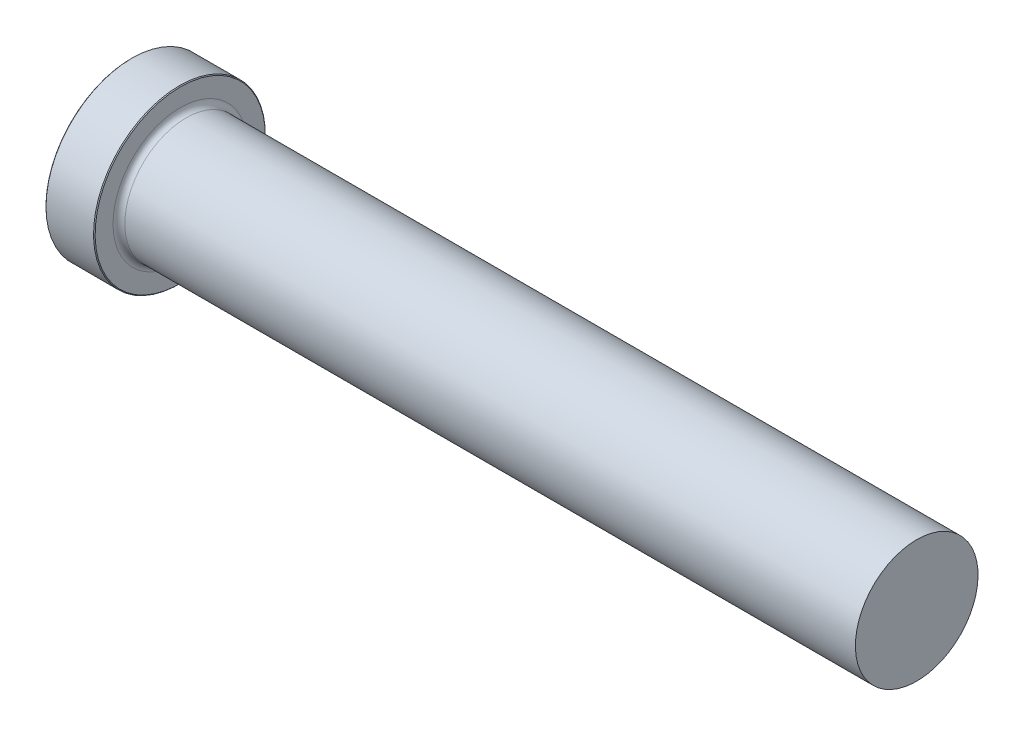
SolidWorks part; units mm, degrees
ref_plane "Front Plane" through (0, 0, 0) normal (0, 0, 1) x (1, 0, 0)
ref_plane "Top Plane" through (0, 0, 0) normal (0, 1, 0) x (1, 0, 0)
ref_plane "Right Plane" through (0, 0, 0) normal (1, 0, 0) x (0, 0, -1)
sketch "Sketch1" plane through (0, 0, 0) normal (0, 0, 1) x (1, 0, 0)
  line L0 (0, 0) -> (0, 11.1125)
  line L1 (0, 11.1125) -> (6.35, 11.1125)
  line L2 (6.35, 11.1125) -> (6.35, 8.6931)
  line L3 (7.112, 7.9311) -> (101.6, 7.9311)
  line L4 (101.6, 7.9311) -> (101.6, 0)
  line L5 (101.6, 0) -> (0, 0)
  line L6 (101.6, 0) -> (101.6, -7.9311) construction
  line L7 (101.6, -7.9311) -> (6.35, -7.9312) construction
  line L8 (0, 0) -> (0, -11.1125) construction
  line L9 (0, -11.1125) -> (6.35, -11.1125) construction
  line L10 (6.35, -11.1125) -> (6.35, -7.9312) construction
  arc A0 (6.35, 8.6931) -> (7.112, 7.9311) centre (7.112, 8.6931) ccw
  dimension "D4" = 0.762
  dimension "L" = 101.6
  dimension "D" = 15.8623
  dimension "H" = 22.225
  dimension "T" = 6.35
revolve "Revolve1" add sketch "Sketch1" angle 360 about L5
chamfer "Chamfer1" distance 0.1016 angle 45 2 edges at (0, 11.1125, 0) (6.35, 11.1125, 0)
